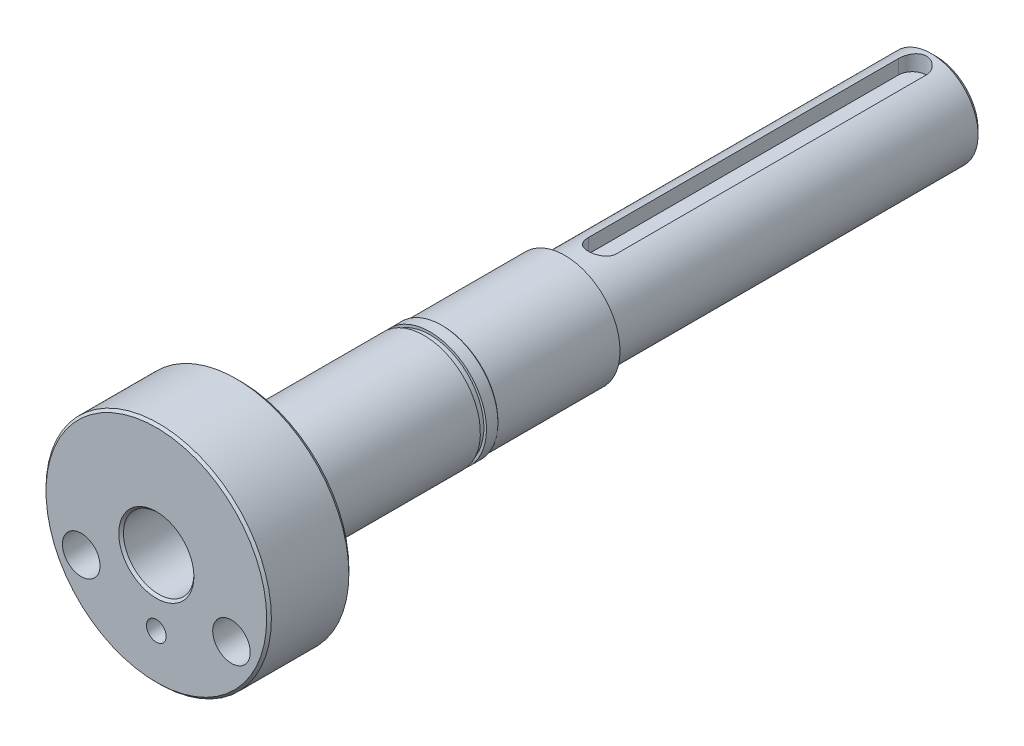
SolidWorks part; units mm, degrees
ref_plane "Face" through (0, 0, 0) normal (0, 0, 1) x (1, 0, 0)
ref_plane "Dessus" through (0, 0, 0) normal (0, 1, 0) x (1, 0, 0)
ref_plane "Droite" through (0, 0, 0) normal (1, 0, 0) x (0, 0, -1)
sketch "Esquisse1" plane through (0, 0, 0) normal (0, 0, 1) x (1, 0, 0)
  circle A0 centre (0, 0) radius 24
  dimension "D1" = 48
extrude "Extrusion1" add sketch "Esquisse1" along normal blind 18
sketch "Esquisse2" plane through (0, 0, 0) normal (0, 0, -1) x (-1, 0, 0)
  circle A0 centre (0, 0) radius 12
  dimension "D1" = 24
extrude "Extrusion2" add sketch "Esquisse2" along normal blind 39
sketch "Esquisse3" plane through (0, 0, -39) normal (0, 0, -1) x (-1, 0, 0)
  circle A0 centre (0, 0) radius 11.45
  dimension "D1" = 22.9
extrude "Extrusion3" add sketch "Esquisse3" along normal blind 1.3
sketch "Esquisse4" plane through (0, 0, -40.3) normal (0, 0, -1) x (-1, 0, 0)
  circle A0 centre (0, 0) radius 12
  dimension "D1" = 24
extrude "Extrusion4" add sketch "Esquisse4" along normal blind 2.7
sketch "Esquisse5" plane through (0, 0, -43) normal (0, 0, -1) x (-1, 0, 0)
  circle A0 centre (0, 0) radius 11.75
  dimension "D1" = 23.5
extrude "Extrusion5" add sketch "Esquisse5" along normal blind 26
sketch "Esquisse6" plane through (0, 0, -69) normal (0, 0, -1) x (-1, 0, 0)
  circle A0 centre (0, 0) radius 10
  dimension "D1" = 20
extrude "Extrusion6" add sketch "Esquisse6" along normal blind 79
chamfer "Chanfrein1" distance 1 angle 45
chamfer "Chanfrein2" distance 0.5 angle 45
sketch "Esquisse7" plane through (0, 0, 0) normal (1, 0, 0) x (0, 0, -1)
  line L0 (-19.0136, 0) -> (40.2237, 0) construction
  line L1 (-17.5, 0) -> (-1, 0) construction
  line L2 (-18, 23.5) -> (-18, -23.5) construction
  line L4 (-18, 7.5) -> (-18, 0)
  line L5 (-18, 7.5) -> (31.7484, 7.5)
  line L6 (31.7484, 7.5) -> (37, 0)
  line L7 (-18, 0) -> (37, 0)
  dimension "D1" = 7.5
  dimension "D2" = 55
  dimension "D3" = 55
revolve "Enlèvement de matière-Révolution1" cut sketch "Esquisse7" angle 360 about L0
chamfer "Chanfrein3" distance 0.5 angle 45
sketch "Esquisse8" plane through (0, 0, 18) normal (0, 0, 1) x (1, 0, 0)
  line L0 (-16, -8) -> (16, -8) construction
  line L1 (0, -8) -> (0, 0) construction
  circle A0 centre (16, -8) radius 4
  circle A1 centre (-16, -8) radius 4
  dimension "D1" = 8
  dimension "D2" = 32
  dimension "D3" = 8
extrude "Enlèv. mat.-Extru.1" cut sketch "Esquisse8" against normal through all
hole_wizard "Trou taraudé M5x0.81" positions "Esquisse10" profile "Esquisse9" tap size "M5x0.8" standard "ISO"
sketch "Esquisse10" plane through (0, 0, 18) normal (0, 0, 1) x (1, 0, 0)
  line L0 (0, -14) -> (0, 0) construction
  point P0 (0, -14)
  dimension "D1" = 14
sketch "Esquisse9" plane through (0, -14, 18) normal (1, 0, 0) x (0, -1, 0)
  line L0 (0, 0) -> (0, 20.1)
  line L1 (0, 20.1) -> (2.1, 18)
  line L2 (2.1, 18) -> (2.1, 0)
  line L5 (2.1, 0) -> (0, 0)
  line L10 (0, 20.1) -> (-2.1, 18) construction
  line L11 (0, -6.35) -> (0, 107.95) construction
  dimension "Diamètre du trou pour taraudage" = 4.2
  dimension "Profondeur du trou pour taraudage" = 18
  dimension "Angle de pointe" = 90
ref_plane "Plan1" through (0, 10, 0) normal (0, 1, 0) x (-1, 0, 0)
sketch "Esquisse11" plane through (0, 10, 0) normal (0, 1, 0) x (-1, 0, 0)
  line L0 (0, -147.8314) -> (0, -143) construction
  line L2 (3, -77) -> (3, -143)
  line L3 (-11.75, -69) -> (11.75, -69) construction
  line L4 (-3, -77) -> (-3, -143)
  line L6 (0, -147) -> (0, -69) construction
  arc A0 (-3, -77) -> (3, -77) centre (0, -77) cw
  arc A1 (-3, -143) -> (3, -143) centre (0, -143) ccw
  dimension "D2" = 5
  dimension "D3" = 72
  dimension "D1" = 6
extrude "Enlèv. mat.-Extru.2" cut sketch "Esquisse11" against normal blind 3.5
hole_wizard "Trou taraudé M6x1.01" positions "Esquisse13" profile "Esquisse12" tap size "M6x1.0" standard "ISO"
sketch "Esquisse13" plane through (0, 0, -148) normal (0, 0, -1) x (-1, 0, 0)
  circle A0 centre (0, 0) radius 9 construction
  point P0 (0, 0)
sketch "Esquisse12" plane through (0, 0, -148) normal (1, 0, 0) x (0, 1, 0)
  line L0 (0, 0) -> (0, 27.5)
  line L1 (0, 27.5) -> (2.5, 25)
  line L2 (2.5, 25) -> (2.5, 0)
  line L5 (2.5, 0) -> (0, 0)
  line L10 (0, 27.5) -> (-2.5, 25) construction
  line L11 (0, -6.35) -> (0, 107.95) construction
  dimension "Diamètre du trou pour taraudage" = 5
  dimension "Profondeur du trou pour taraudage" = 25
  dimension "Angle de pointe" = 90
chamfer "Chanfrein4" distance 0.25 angle 45
